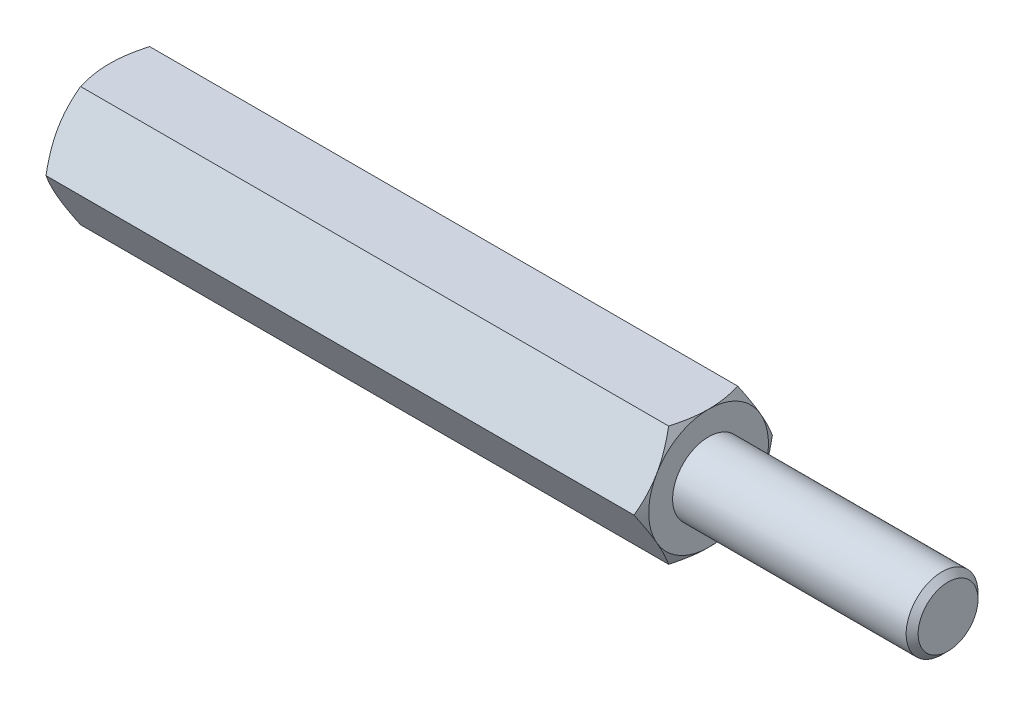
SolidWorks part; units mm, degrees
ref_plane "Front Plane" through (0, 0, 0) normal (0, 0, 1) x (1, 0, 0)
ref_plane "Top Plane" through (0, 0, 0) normal (0, 1, 0) x (1, 0, 0)
ref_plane "Right Plane" through (0, 0, 0) normal (1, 0, 0) x (0, 0, -1)
sketch "Sketch1" plane through (0, 0, 0) normal (1, 0, 0) x (0, 0, -1)
  line L1 (1.4434, 2.5) -> (-1.4434, 2.5)
  line L2 (-1.4434, 2.5) -> (-2.8868, 0)
  line L3 (-2.8868, 0) -> (-1.4434, -2.5)
  line L4 (-1.4434, -2.5) -> (1.4434, -2.5)
  line L5 (1.4434, -2.5) -> (2.8868, 0)
  line L6 (2.8868, 0) -> (1.4434, 2.5)
  circle A0 centre (0, 0) radius 2.5 construction
  dimension "D1" = 5
extrude "Extrude2" add sketch "Sketch1" along normal mid plane 25
sketch "Sketch2" plane through (0, 0, 0) normal (0, 0, 1) x (1, 0, 0)
  line L0 (-12.5, 2.5) -> (-11, 5.0981)
  line L1 (-12.5, 5.5) -> (-12.5, 2.5)
  line L3 (0, 0) -> (50000, 0) construction
  arc A0 (-11, 5.0981) -> (-12.5, 5.5) centre (-11.6962, 5.5) ccw
  dimension "D1" = 30
  dimension "D2" = 3
revolve "Cut-Revolve1" cut sketch "Sketch2" angle 360 about L3
mirror "Mirror1" about plane through (0, 0, 0) normal (1, 0, 0) of "Cut-Revolve1"
sketch "Sketch3" plane through (-12.5, 0, 0) normal (-1, 0, 0) x (0, 0, 1)
  circle A0 centre (0, 0) radius 1.25
  dimension "D1" = 2.5
extrude "Extrude3" cut sketch "Sketch3" against normal blind 10
sketch "Sketch4" plane through (0, 0, 0) normal (0, 0, 1) x (1, 0, 0)
  line L0 (-2.5, 0) -> (-2.5, 1.25)
  line L1 (12.2767, 0) -> (-12.2767, 0) construction
  line L2 (-2.5, 1.25) -> (-1.7783, 0)
  line L3 (-1.7783, 0) -> (-2.5, 0)
  line L4 (-12.5, 1.25) -> (-12.5, -1.25) construction
  point P4 (-12.5, 0)
  dimension "D1" = 30
  dimension "D2" = 1.25
  dimension "D3" = 10
revolve "Cut-Revolve2" cut sketch "Sketch4" angle 360 about L3
sketch "Sketch5" plane through (12.5, 0, 0) normal (1, 0, 0) x (0, 0, -1)
  circle A0 centre (0, 0) radius 1.5
  dimension "D1" = 3
extrude "Extrude4" add sketch "Sketch5" along normal blind 10
chamfer "Chamfer1" distance 0.25 angle 45 1 edges at (22.5, 0, -1.5)
equation "\"D2@Sketch4\" = \"D1@Sketch3\"/2"
